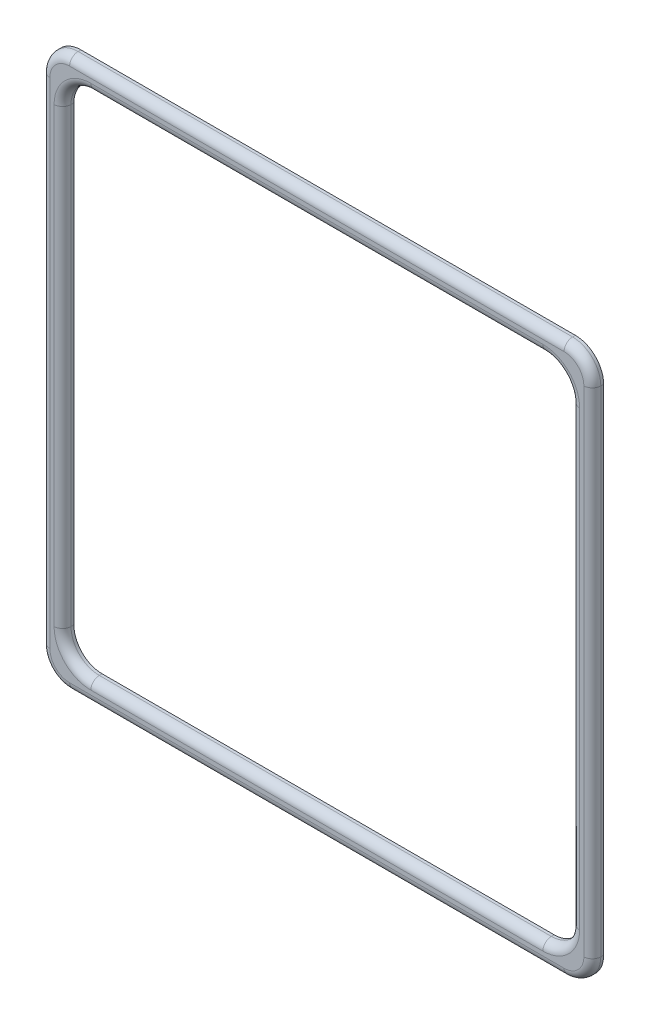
SolidWorks part; units mm, degrees
ref_plane "Plan de face" through (0, 0, 0) normal (0, 0, 1) x (1, 0, 0)
ref_plane "Plan de dessus" through (0, 0, 0) normal (0, 1, 0) x (1, 0, 0)
ref_plane "Plan de droite" through (0, 0, 0) normal (1, 0, 0) x (0, 0, -1)
sketch "Esquisse1" plane through (0, 0, 0) normal (0, 0, 1) x (1, 0, 0)
  line L1 (20, 0) -> (370, 0)
  line L2 (0, 20) -> (0, 370)
  line L3 (20, 390) -> (370, 390)
  line L4 (390, 20) -> (390, 370)
  line L5 (35, 375) -> (355, 375)
  line L6 (15, 355) -> (15, 35)
  line L7 (35, 15) -> (355, 15)
  line L8 (375, 355) -> (375, 35)
  arc A0 (0, 370) -> (20, 390) centre (20, 370) cw
  arc A1 (370, 390) -> (390, 370) centre (370, 370) cw
  arc A2 (370, 0) -> (390, 20) centre (370, 20) ccw
  arc A3 (20, 0) -> (0, 20) centre (20, 20) cw
  arc A4 (15, 35) -> (35, 15) centre (35, 35) ccw
  arc A5 (355, 15) -> (375, 35) centre (355, 35) ccw
  arc A6 (355, 375) -> (375, 355) centre (355, 355) cw
  arc A7 (35, 375) -> (15, 355) centre (35, 355) ccw
  point P13 (390, 390)
  point P16 (390, 0)
  point P19 (0, 0)
  dimension "D7" = 20
  dimension "D1" = 15
  dimension "D2" = 15
  dimension "D3" = 15
  dimension "D4" = 15
  dimension "D5" = 390
  dimension "D6" = 390
extrude "Boss.-Extru.1" add sketch "Esquisse1" along normal blind 8
fillet "Congé2" radius 6 16 edges at (195, 15, 8) (375, 195, 8) (195, 375, 8) (15, 195, 8) (195, 390, 8) (390, 195, 8) (195, 0, 8) (0, 195, 8) (369.1421, 20.8579, 8) (369.1421, 369.1421, 8) (20.8579, 369.1421, 8) (20.8579, 20.8579, 8) (384.1421, 384.1421, 8) (384.1421, 5.8579, 8) (5.8579, 5.8579, 8) (5.8579, 384.1421, 8)
